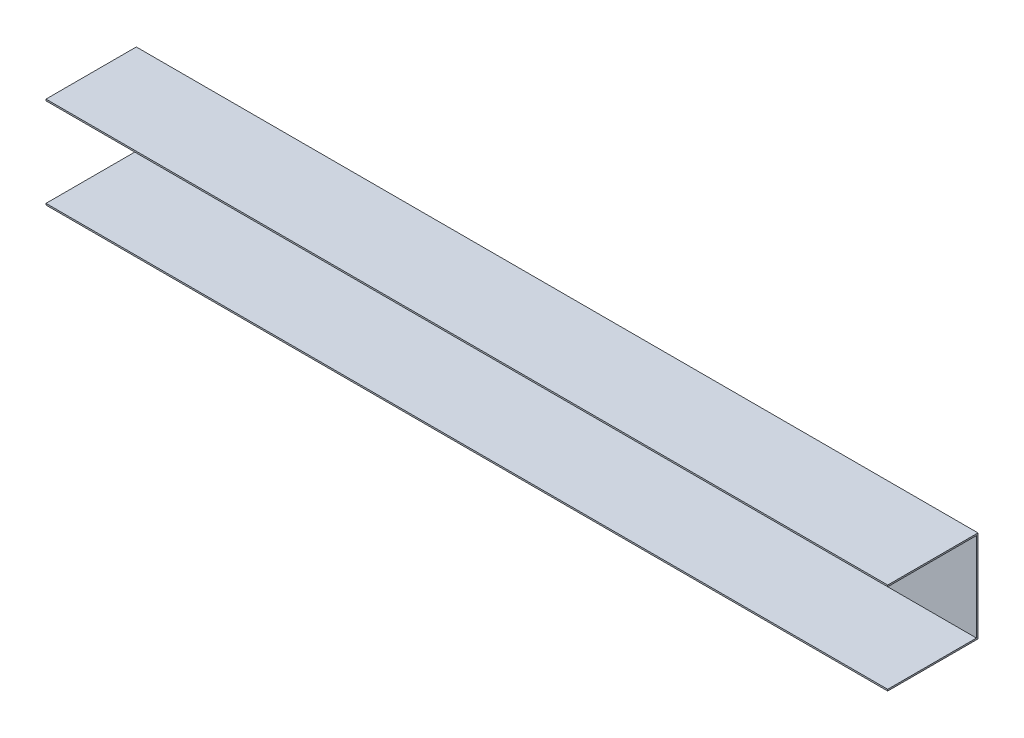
SolidWorks part; units mm, degrees
ref_plane "Plan de face" through (0, 0, 0) normal (0, 0, 1) x (1, 0, 0)
ref_plane "Plan de dessus" through (0, 0, 0) normal (0, 1, 0) x (1, 0, 0)
ref_plane "Plan de droite" through (0, 0, 0) normal (1, 0, 0) x (0, 0, -1)
sketch "EW_SKETCH" plane through (0, 0, 0) normal (1, 0, 0) x (0, 0, -1)
  line L0 (0, -30) -> (0, 30)
  line L1 (0, 30) -> (-59, 30)
  line L2 (-59, 30) -> (-59, 29)
  line L3 (-59, 29) -> (-1, 29)
  line L4 (-1, 29) -> (-1, -29)
  line L5 (-1, -29) -> (-59, -29)
  line L6 (-59, -29) -> (-59, -30)
  line L7 (-59, -30) -> (0, -30)
  line L8 (-60, 0) -> (0, 0) construction
  point P11 (-30, 0)
extrude "EW_EXTRUDE" add sketch "EW_SKETCH" along normal blind 550
equation "\"th_duct@EW_SKETCH\"=1"
equation "\"th_duct_form@EW_SKETCH\"=\"th_duct@EW_SKETCH\""
